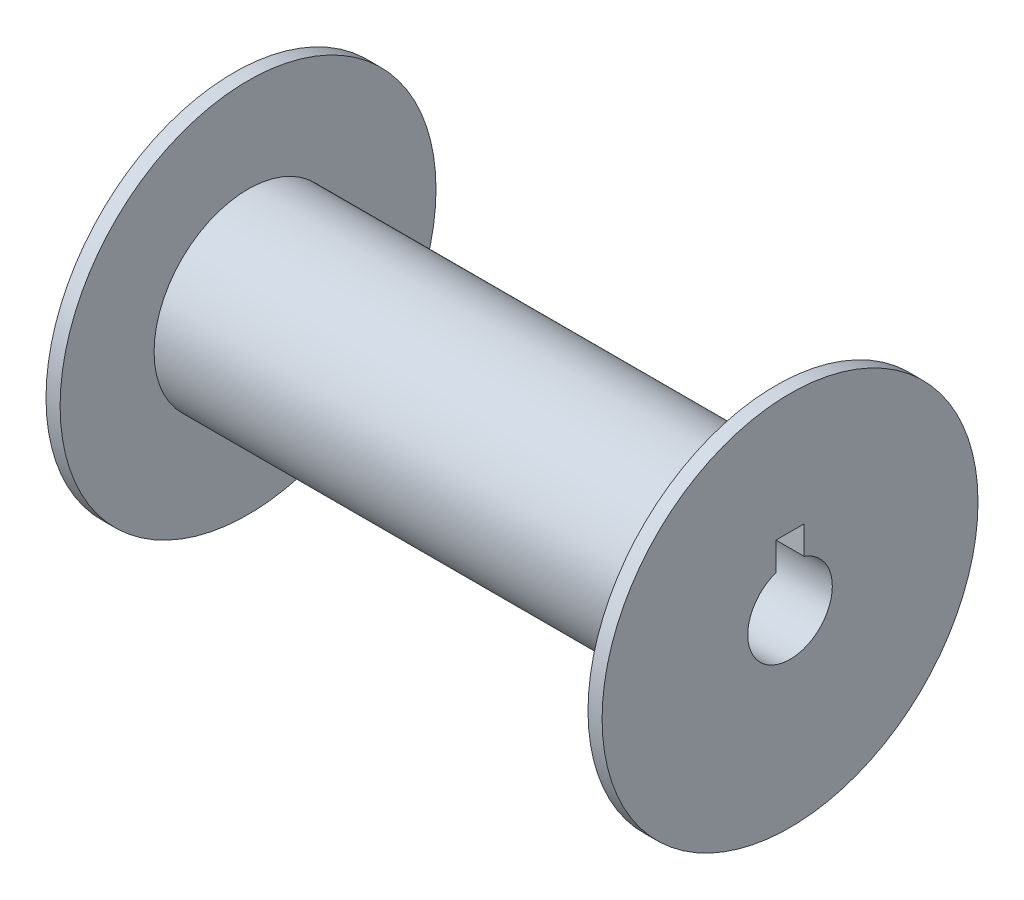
SolidWorks part; units mm, degrees
ref_plane "Front Plane" through (0, 0, 0) normal (0, 0, 1) x (1, 0, 0)
ref_plane "Top Plane" through (0, 0, 0) normal (0, 1, 0) x (1, 0, 0)
ref_plane "Right Plane" through (0, 0, 0) normal (1, 0, 0) x (0, 0, -1)
sketch "Sketch1" plane through (0, 0, 0) normal (1, 0, 0) x (0, 0, -1)
  line L0 (-3, 8.4853) -> (-3, 14.4853)
  line L1 (3, 8.4853) -> (3, 14.4853)
  line L2 (-3, 14.4853) -> (3, 14.4853)
  arc A0 (-3, 8.4853) -> (3, 8.4853) centre (0, 0) ccw
  circle A1 centre (0, 0) radius 40
  dimension "D1" = 18
  dimension "D2" = 80
  dimension "D3" = 6
  dimension "D4" = 6
extrude "Boss-Extrude1" add sketch "Sketch1" along normal blind 118.35
sketch "Sketch2" plane through (0, 0, 0) normal (0, 1, 0) x (1, 0, 0)
  line L0 (0, 0) -> (118.35, 0) construction
  line L1 (0, 40) -> (0, -40) construction
  line L2 (118.35, -40) -> (118.35, 40) construction
  line L3 (59.175, 0) -> (59.175, 20) construction
  line L4 (3, 40) -> (115.35, 40)
  line L5 (3, 40) -> (3, 20)
  line L6 (3, 20) -> (115.35, 20)
  line L7 (115.35, 40) -> (115.35, 20)
  line L8 (118.35, 40) -> (0, 40) construction
  point P6 (59.175, 0)
  point P11 (59.175, 20)
  point P14 (0, 0)
  dimension "D1" = 20
  dimension "D2" = 3
revolve "Cut-Revolve1" cut sketch "Sketch2" angle 360 about L0
